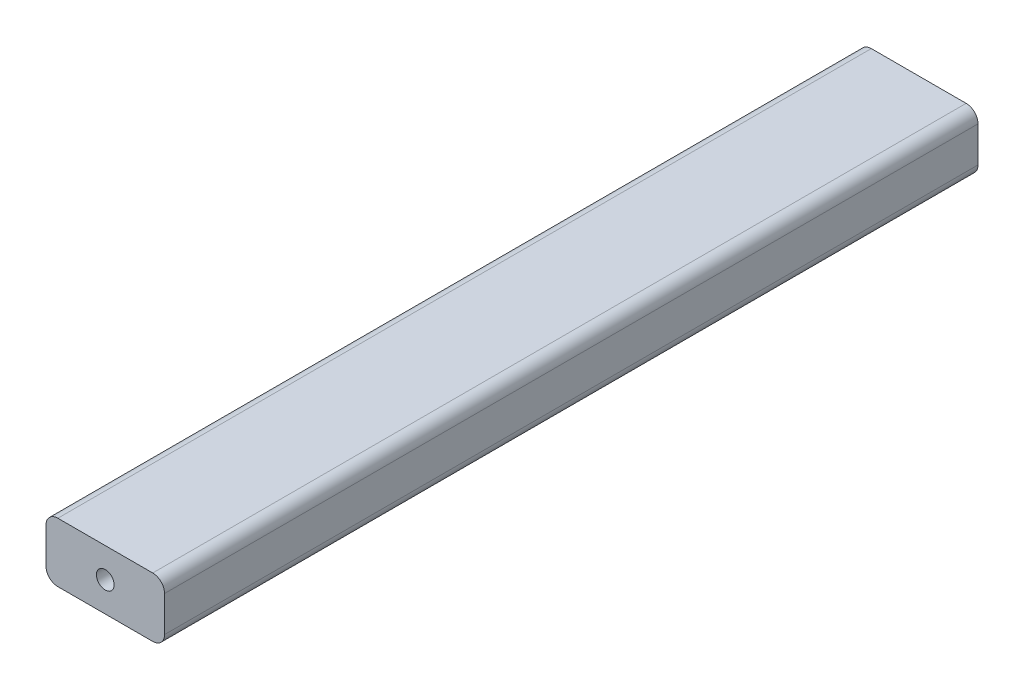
SolidWorks part; units mm, degrees
ref_plane "Front Plane" through (0, 0, 0) normal (0, 0, 1) x (1, 0, 0)
ref_plane "Top Plane" through (0, 0, 0) normal (0, 1, 0) x (1, 0, 0)
ref_plane "Right Plane" through (0, 0, 0) normal (1, 0, 0) x (0, 0, -1)
sketch "Sketch1" plane through (0, 0, 0) normal (0, 0, 1) x (1, 0, 0)
  line L1 (-13.589, 53.4416) -> (11.811, 53.4416)
  line L2 (-13.589, 53.4416) -> (-13.589, 40.7416)
  line L3 (-13.589, 40.7416) -> (11.811, 40.7416)
  line L4 (11.811, 53.4416) -> (11.811, 40.7416)
  dimension "D1" = 25.4
  dimension "D3" = 12.7
extrude "Boss-Extrude1" add sketch "Sketch1" along normal mid plane 174.2694
fillet "Fillet1" radius 2.54 4 edges at (-13.589, 40.7416, 0) (-13.589, 53.4416, 0) (11.811, 40.7416, 0) (11.811, 53.4416, 0)
hole_wizard "#10-24 Tapped Hole1" positions "Sketch4" profile "Sketch3" tap size "#10-24" standard "ANSI Inch"
sketch "Sketch4" plane through (0, 0, 87.1347) normal (0, 0, 1) x (1, 0, 0)
  line L2 (-16.2417, 47.0916) -> (18.3136, 47.0916) construction
  line L5 (-0.889, 55.8752) -> (-0.889, 38.3952) construction
  line L10 (9.271, 53.4416) -> (-11.049, 53.4416) construction
  line L11 (-11.049, 40.7416) -> (9.271, 40.7416) construction
  line L18 (-13.589, 50.9016) -> (-13.589, 43.2816) construction
  line L19 (11.811, 43.2816) -> (11.811, 50.9016) construction
  point P0 (-0.889, 47.0916)
sketch "Sketch3" plane through (-0.889, 47.0916, 87.1347) normal (1, 0, 0) x (0, -1, 0)
  line L0 (0, 0) -> (0, 16.0887)
  line L1 (0, 16.0887) -> (1.8986, 14.9479)
  line L2 (1.8986, 14.9479) -> (1.8986, 0)
  line L5 (1.8986, 0) -> (0, 0)
  line L10 (0, 16.0887) -> (-1.8987, 14.9479) construction
  line L11 (0, -6.35) -> (0, 107.95) construction
  dimension "Tap Drill Dia." = 3.7973
  dimension "Tap Drill Depth" = 14.9479
  dimension "Drill Angle" = 118
mirror "Mirror1" about plane through (0, 0, 0) normal (0, 0, 1) of "#10-24 Tapped Hole1"
